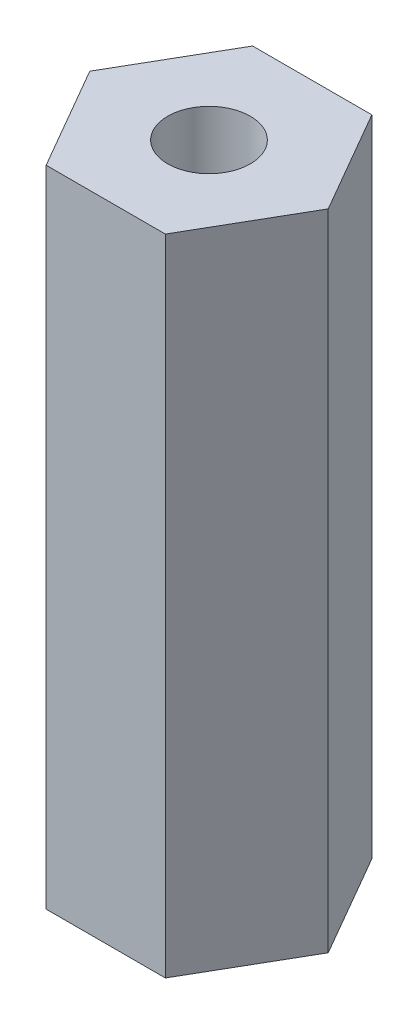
SolidWorks part; units mm, degrees
ref_plane "Front Plane" through (0, 0, 0) normal (0, 0, 1) x (1, 0, 0)
ref_plane "Top Plane" through (0, 0, 0) normal (0, 1, 0) x (1, 0, 0)
ref_plane "Right Plane" through (0, 0, 0) normal (1, 0, 0) x (0, 0, -1)
sketch "Sketch1" plane through (0, 0, 0) normal (0, 1, 0) x (1, 0, 0)
  line L0 (3.6662, 0) -> (0, 0) construction
  line L1 (3.6662, 0) -> (1.8331, 3.175)
  line L2 (1.8331, 3.175) -> (-1.8331, 3.175)
  line L3 (-1.8331, 3.175) -> (-3.6662, 0)
  line L4 (-3.6662, 0) -> (-1.8331, -3.175)
  line L5 (-1.8331, -3.175) -> (1.8331, -3.175)
  line L6 (1.8331, -3.175) -> (3.6662, 0)
  circle A0 centre (0, 0) radius 3.175 construction
  circle A1 centre (0, 0) radius 1.27
  dimension "D1" = 6.35
  dimension "D2" = 2.54
extrude "Boss-Extrude1" add sketch "Sketch1" along normal blind 19.812 contours L3 L4 L5 L6 L1 L2
